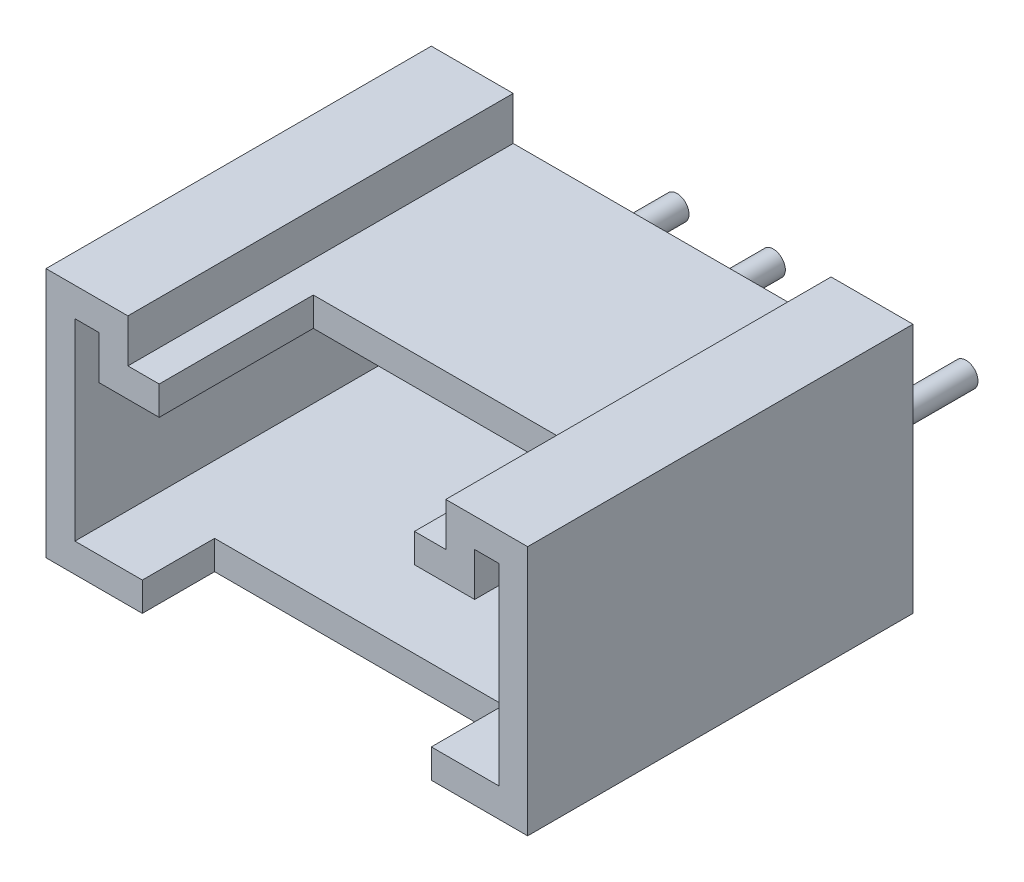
SolidWorks part; units mm, degrees
ref_plane "Plan de face" through (0, 0, 0) normal (0, 0, 1) x (1, 0, 0)
ref_plane "Plan de dessus" through (0, 0, 0) normal (0, 1, 0) x (1, 0, 0)
ref_plane "Plan de droite" through (0, 0, 0) normal (1, 0, 0) x (0, 0, -1)
sketch "Esquisse1" plane through (0, 0, 0) normal (0, 0, 1) x (1, 0, 0)
  line L0 (0, -0.7338) -> (0, 11.4237) construction
  line L1 (10.4191, 0) -> (-0.9801, 0) construction
  line L2 (5, -0.7338) -> (5, 11.4237) construction
  line L3 (3.3, 8.9308) -> (3.3, 3.7217) construction
  line L4 (10.4191, 5.2) -> (-0.9801, 5.2) construction
  line L5 (8.0741, 4.3) -> (-0.9801, 4.3) construction
  line L6 (3.3, 4.3) -> (3.3, 5.2)
  line L7 (3.3, 5.2) -> (5, 5.2)
  line L8 (5, 5.2) -> (5, 0)
  line L9 (-5, 5.2) -> (-5, 0)
  line L10 (-3.3, 5.2) -> (-5, 5.2)
  line L11 (-3.3, 4.3) -> (-3.3, 5.2)
  line L12 (-3.3, 4.3) -> (3.3, 4.3)
  line L13 (-5, 0) -> (5, 0)
  dimension "D1" = 5.2
  dimension "D2" = 5
  dimension "D3" = 3.3
  dimension "D4" = 0.9
extrude "Boss.-Extru.1" add sketch "Esquisse1" along normal blind 8
shell "Coque1" thickness 0.6
sketch "Esquisse2" plane through (0, 0, 0) normal (0, 0, -1) x (-1, 0, 0)
  line L0 (0, 0) -> (0, 3.5968) construction
  line L1 (-1, 3.5968) -> (-1, -0.6063) construction
  circle A0 centre (-1, 1.7522) radius 0.25
  circle A1 centre (1, 1.7522) radius 0.25
  circle A2 centre (3, 1.7522) radius 0.25
  circle A3 centre (-3, 1.7522) radius 0.25
  dimension "D1" = 1
  dimension "D2" = 3
extrude "Boss.-Extru.2" add sketch "Esquisse2" along normal blind 3.1
sketch "Esquisse3" plane through (0, 0, 0) normal (0, -1, 0) x (1, 0, 0)
  line L0 (-5, 8) -> (5, 8) construction
  line L1 (-3, 8) -> (3, 8)
  line L2 (-3, 8) -> (-3, 6.5)
  line L3 (-3, 6.5) -> (3, 6.5)
  line L4 (3, 8) -> (3, 6.5)
  line L5 (-5, 8) -> (-5, 0) construction
  dimension "D1" = 2
  dimension "D2" = 6
  dimension "D3" = 1.5
extrude "Enlèv. mat.-Extru.1" cut sketch "Esquisse3" against normal blind 0.6
sketch "Esquisse4" plane through (0, 4.3, 0) normal (0, 1, 0) x (1, 0, 0)
  line L0 (0, -8) -> (0, -4.4575) construction
  line L1 (3.3, -8) -> (-3.3, -8) construction
  line L3 (-2.65, -8) -> (2.65, -8)
  line L4 (-2.65, -8) -> (-2.65, -4.8)
  line L5 (-2.65, -4.8) -> (2.65, -4.8)
  line L6 (2.65, -8) -> (2.65, -4.8)
  dimension "D1" = 2.65
extrude "Enlèv. mat.-Extru.2" cut sketch "Esquisse4" against normal blind 0.6
